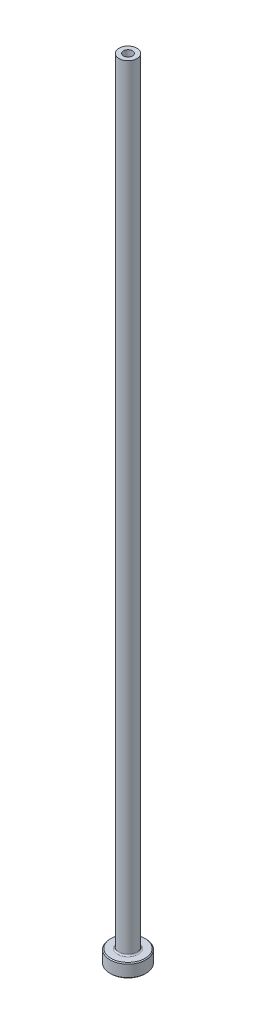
SolidWorks part; units mm, degrees
ref_plane "Front Plane" through (0, 0, 0) normal (0, 0, 1) x (1, 0, 0)
ref_plane "Top Plane" through (0, 0, 0) normal (0, 1, 0) x (1, 0, 0)
ref_plane "Right Plane" through (0, 0, 0) normal (1, 0, 0) x (0, 0, -1)
sketch "Sketch1" plane through (0, 0, 0) normal (0, 0, 1) x (1, 0, 0)
  line L0 (-1, 175) -> (-2, 175)
  line L1 (-2, 175) -> (-2, 3)
  line L2 (-2, 3) -> (-4, 3)
  line L3 (-4, 3) -> (-4, 0)
  line L4 (4.4, 0) -> (-4.4, 0) construction
  line L5 (-4, 0) -> (-1.25, 0)
  line L6 (-1, 140) -> (-1, 175)
  line L7 (0, 92.1877) -> (0, -15.5353) construction
  line L8 (0, -4.4) -> (0, 4.4) construction
  line L9 (-1, 140) -> (-1.25, 128)
  line L10 (-1.25, 128) -> (-1.25, 0)
  dimension "D1" = 0.25
  dimension "ID" = 2
  dimension "OD" = 4
  dimension "L" = 175
  dimension "H" = 8
  dimension "T" = 3
  dimension "N" = 35
  dimension "D2" = 12
revolve "Revolve1" add sketch "Sketch1" angle 360 about L7
fillet "Fillet1" radius 0.3 1 edges at (0, 3, 2)
chamfer "Chamfer1" distance 0.2 angle 45 2 edges at (0, 3, 4) (0, 0, 4)
chamfer "Chamfer3" distance 0.5 angle 45 1 edges at (0, 0, 1.25)
